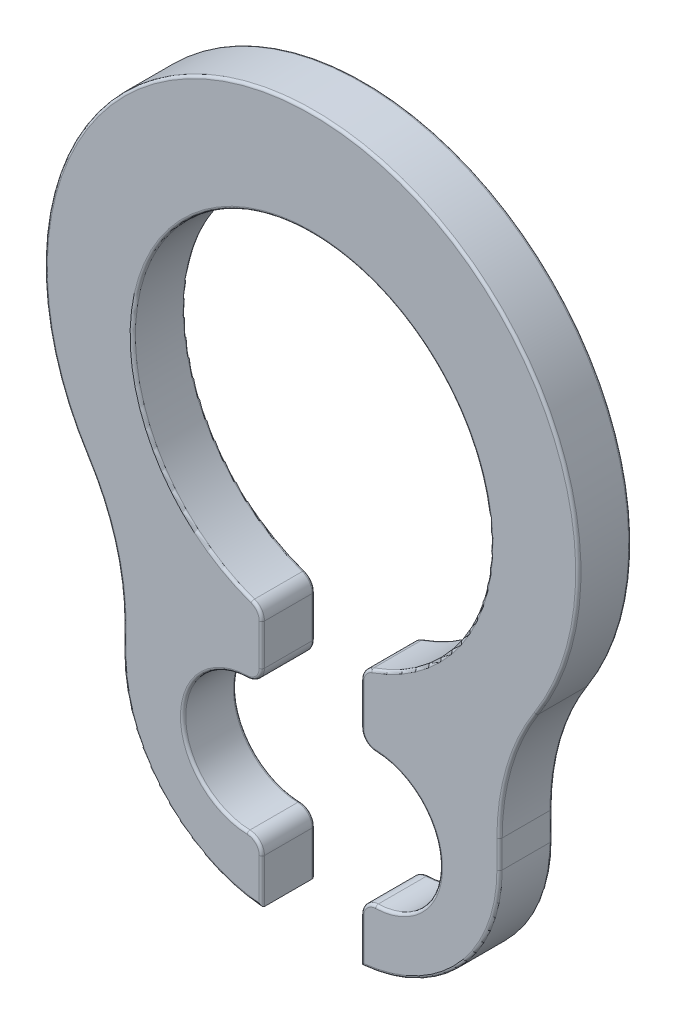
SolidWorks part; units mm, degrees
ref_plane "Front Plane" through (0, 0, 0) normal (0, 0, 1) x (1, 0, 0)
ref_plane "Top Plane" through (0, 0, 0) normal (0, 1, 0) x (1, 0, 0)
ref_plane "Right Plane" through (0, 0, 0) normal (1, 0, 0) x (0, 0, -1)
sketch "Sketch1" plane through (0, 0, 0) normal (0, 0, 1) x (1, 0, 0)
  line L0 (0, 2.7) -> (0, -2.7) construction
  line L1 (-0.47, -1.75) -> (0.47, -1.75) construction
  line L2 (-0.47, -1.25) -> (0.47, -1.25)
  line L3 (-0.47, -2.25) -> (0.47, -2.25)
  line L4 (0.97, -1.75) -> (1.42, -1.75) construction
  line L5 (0, -0.8) -> (0, -1.25) construction
  circle A0 centre (0, 0.55) radius 1.35
  arc A3 (-0.47, -1.25) -> (-0.47, -2.25) centre (-0.47, -1.75) ccw
  arc A4 (0.47, -2.25) -> (0.47, -1.25) centre (0.47, -1.75) ccw
  circle A5 centre (0, 0.685) radius 2.015 construction
  circle A6 centre (0, 0.55) radius 1.5 construction
  circle A7 centre (0, 0.55) radius 1.4 construction
  point P6 (0, 1.9)
  point P7 (0, -0.8)
  point P10 (0, -1.75)
sketch "Sketch2" plane through (0, 0, 0) normal (1, 0, 0) x (0, 0, -1)
  line L0 (-0.2, 2.7) -> (0.2, 2.7) construction
  line L1 (0, 3.8) -> (0, -2.7) construction
  line L2 (0, 2.7) -> (0, -2.7) construction
  line L3 (-0.25, 3.8) -> (0.25, 3.8) construction
  line L4 (-0.25, -2.7) -> (0.25, -2.7) construction
sketch "Sketch3" plane through (0, 0, 0) normal (0, 0, 1) x (1, 0, 0)
  line L0 (-0.47, -2.25) -> (0.47, -2.25) construction
  line L1 (-0.47, -1.25) -> (0.47, -1.25) construction
  line L2 (-0.47, -2.25) -> (0.47, -2.25)
  line L3 (-0.47, -1.25) -> (0.47, -1.25)
  line L4 (1.42, -1.3503) -> (1.42, -1.56)
  line L5 (-0.28, -2.7) -> (0.28, -2.7)
  line L6 (-1.42, -1.3503) -> (-1.42, -1.56)
  line L7 (-0.97, -1.75) -> (-1.42, -1.75) construction
  line L8 (0.97, -1.75) -> (1.42, -1.75) construction
  arc A0 (-0.47, -1.25) -> (-0.47, -2.25) centre (-0.47, -1.75) ccw construction
  arc A1 (0.47, -2.25) -> (0.47, -1.25) centre (0.47, -1.75) ccw construction
  arc A2 (-0.47, -1.25) -> (-0.47, -2.25) centre (-0.47, -1.75) ccw
  arc A3 (0.47, -2.25) -> (0.47, -1.25) centre (0.47, -1.75) ccw
  circle A4 centre (0, 0.55) radius 1.35 construction
  circle A5 centre (0, 0.55) radius 1.35
  arc A6 (-1.6977, -0.4003) -> (1.6977, -0.4003) centre (0, 0.685) cw
  arc A8 (1.6977, -0.4003) -> (1.42, -1.3503) centre (3.1837, -1.3503) ccw
  arc A9 (1.42, -1.56) -> (0.28, -2.7) centre (0.28, -1.56) cw
  arc A10 (-1.6977, -0.4003) -> (-1.42, -1.3503) centre (-3.1837, -1.3503) cw
  arc A11 (-1.42, -1.56) -> (-0.28, -2.7) centre (-0.28, -1.56) ccw
  circle A12 centre (0, 0.685) radius 2.015 construction
extrude "Boss-Extrude1" add sketch "Sketch3" along normal mid plane 0.4
sketch "Sketch4" plane through (0, 0, 0) normal (0, 0, 1) x (1, 0, 0)
  line L0 (0, 0.55) -> (0, -2.7)
extrude "Cut-Extrude-Thin1" cut sketch "Sketch4" against normal through all both and the other way through all thin
fillet "Fillet2" radius 0.1125 6 edges at (0.375, -2.25, 0) (-0.375, -2.25, 0) (0.375, -1.25, 0) (0.375, -0.7469, 0) (-0.375, -1.25, 0) (-0.375, -0.7469, 0)
fillet "Fillet1" radius 0.02 40 edges at (-0.97, -1.75, -0.2) (0, 1.9, -0.2) (0.97, -1.75, -0.2) (1.119, -2.3318, -0.2) (1.42, -1.4552, -0.2) (1.4909, -0.8555, -0.2) (0, 2.7, -0.2) (-1.4909, -0.8555, -0.2) (-1.42, -1.4552, -0.2) (-1.119, -2.3318, -0.2) (-1.119, -2.3318, 0.2) (-1.42, -1.4552, 0.2) (-1.4909, -0.8555, 0.2) (0, 2.7, 0.2) (1.4909, -0.8555, 0.2) (1.42, -1.4552, 0.2) (1.119, -2.3318, 0.2) (0.97, -1.75, 0.2) (0, 1.9, 0.2) (-0.97, -1.75, 0.2) (-0.4068, -2.2838, -0.2) (-0.4068, -1.2162, -0.2) (-0.375, -0.9833, -0.2) (-0.3956, -0.7639, -0.2) (0.3956, -0.7639, -0.2) (0.375, -0.9833, -0.2) (0.4068, -1.2162, -0.2) (0.4068, -2.2838, -0.2) (0.4068, -1.2162, 0.2) (0.375, -0.9833, 0.2) (0.3956, -0.7639, 0.2) (-0.3956, -0.7639, 0.2) (-0.375, -0.9833, 0.2) (-0.4068, -1.2162, 0.2) (-0.4068, -2.2838, 0.2) (0.4068, -2.2838, 0.2) (-0.375, -2.5291, -0.2) (0.375, -2.5291, -0.2) (-0.375, -2.5291, 0.2) (0.375, -2.5291, 0.2)
equation "\"D3@Sketch1\"=\"Tap Height@Sketch1\"*0.5"
equation "\"D1@Sketch3\"=\"Tap Height@Sketch1\"*0.5"
equation "\"D2@Sketch3\"=\"Tap Height@Sketch1\"*0.6"
equation "\"D1@Boss-Extrude1\" = \"Thickness@Sketch2\""
equation "\"D1@Sketch1\"= \"ID@Sketch1\" * 0.05"
equation "\"D1@Fillet2\"=\"D3@Sketch3\"*0.25"
